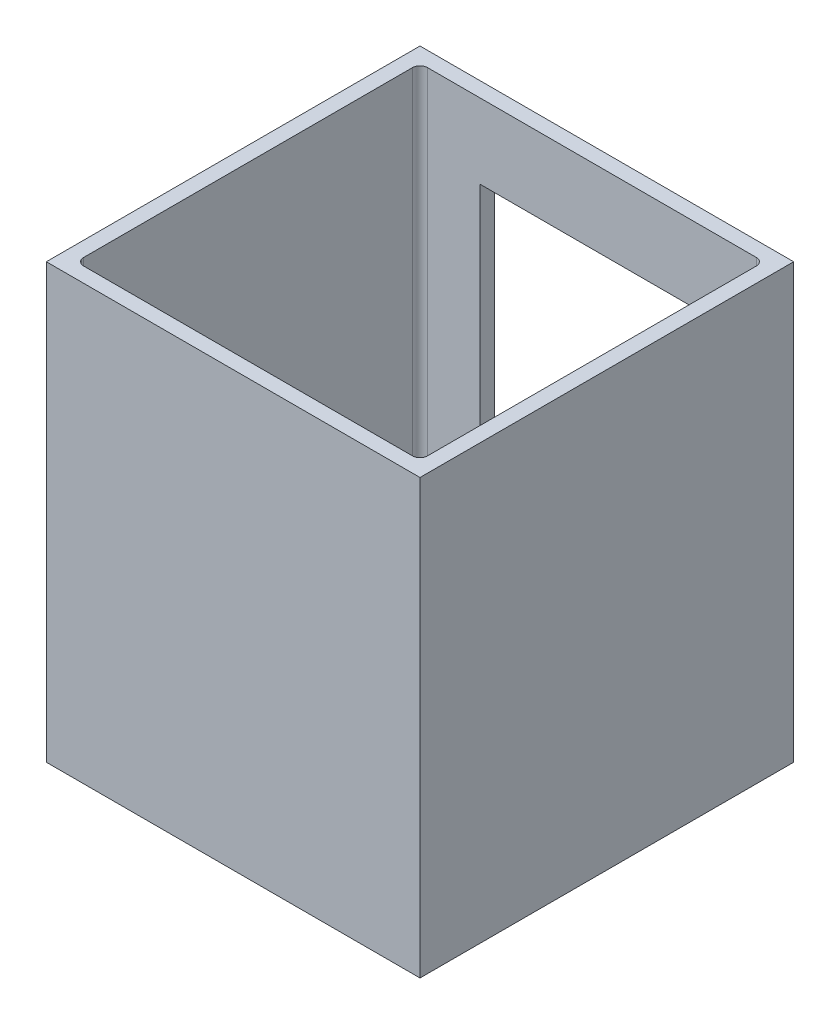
SolidWorks part; units mm, degrees
other "Markup1"
sketch "Sketch15" plane through (63.5, 0, 0) normal (0.5774, 0.5773, 0.5774) x (0.7071, 0, -0.7071)
ref_plane "Front Plane" through (0, 0, 0) normal (0, 0, 1) x (1, 0, 0)
ref_plane "Top Plane" through (0, 0, 0) normal (0, 1, 0) x (1, 0, 0)
ref_plane "Right Plane" through (0, 0, 0) normal (1, 0, 0) x (0, 0, -1)
sketch "Sketch2" plane through (0, 0, 0) normal (0, 1, 0) x (1, 0, 0)
  line L1 (0, 0) -> (63.5, 0)
  line L2 (0, 0) -> (0, 63.5)
  line L3 (0, 63.5) -> (63.5, 63.5)
  line L4 (63.5, 0) -> (63.5, 63.5)
extrude "Boss-Extrude2" add sketch "Sketch2" against normal blind 304.8
sketch "Sketch3" plane through (0, 0, 0) normal (0, 1, 0) x (1, 0, 0)
  line L0 (0, 0) -> (0, 2.54)
  line L1 (0, 63.5) -> (0, 0) construction
  line L2 (0, 2.54) -> (2.54, 2.54)
  line L3 (63.5, 63.5) -> (63.5, 60.96)
  line L4 (63.5, 60.96) -> (60.96, 60.96)
  line L6 (2.54, 2.54) -> (60.96, 2.54)
  line L7 (2.54, 2.54) -> (2.54, 60.96)
  line L8 (2.54, 60.96) -> (60.96, 60.96)
  line L9 (60.96, 2.54) -> (60.96, 60.96)
extrude "Cut-Extrude2" cut sketch "Sketch3" against normal blind 302.26 contours L6 L9 L8 L7
sketch3d "3DSketch1"
  line L0 (0, 0, -63.5) -> (0, 0, 0) construction
  point P0 (0, 0, -61.7439)
sketch "Sketch5" plane through (0, 0, 0) normal (0, 1, 0) x (1, 0, 0)
  line L1 (0, 0) -> (63.5, 0)
  line L2 (0, 0) -> (0, 63.5)
  line L3 (0, 63.5) -> (63.5, 63.5)
  line L4 (63.5, 0) -> (63.5, 63.5)
extrude "Cut-Extrude3" cut sketch "Sketch5" against normal blind 2.54
sketch "Sketch6" plane through (0, 0, 0) normal (0, 0, 1) x (1, 0, 0)
  line L0 (0, -304.8) -> (63.5, -304.8)
  line L1 (63.5, -304.8) -> (31.75, -304.8)
  line L2 (31.75, -304.8) -> (31.75, -152.4)
  circle A0 centre (31.75, -152.4) radius 12.7
extrude "Cut-Extrude4" cut sketch "Sketch6" against normal blind 12.7
sketch "Sketch11" plane through (0, 0, 0) normal (0, 0, 1) x (1, 0, 0)
  line L0 (31.75, -152.4) -> (31.75, -158.75)
  line L1 (44.45, -152.4) -> (44.45, -173.6752)
  line L2 (19.05, -152.4) -> (19.05, -158.75)
  circle A0 centre (31.75, -152.4) radius 12.7 construction
  circle A1 centre (31.75, -158.75) radius 12.7
extrude "Cut-Extrude7" cut sketch "Sketch11" against normal blind 2.54 contours A1 L2 M3 | A1 M3 | A1 L1 M3
sketch "Sketch12" plane through (0, 0, 0) normal (0, 0, 1) x (1, 0, 0)
  line L0 (31.75, -152.4) -> (31.75, -146.05)
  line L1 (19.05, -146.05) -> (19.05, -155.575)
  line L2 (19.05, -152.4) -> (19.05, -158.75) construction
  line L3 (44.45, -146.05) -> (44.45, -158.75)
  circle A0 centre (31.75, -146.05) radius 12.7
extrude "Cut-Extrude8" cut sketch "Sketch12" against normal blind 2.54 contours A0 M3 | A0 L1 M3 | A0 L3 M3
sketch "Sketch14" plane through (0, 0, -63.5) normal (0, 0, -1) x (-1, 0, 0)
  line L0 (-63.5, -304.8) -> (-50.8, -304.8)
  line L1 (-63.5, -304.8) -> (0, -304.8) construction
  line L2 (-50.8, -304.8) -> (-50.8, -292.1)
  line L3 (0, -2.54) -> (0, -15.24)
  line L4 (0, -304.8) -> (0, -2.54) construction
  line L5 (0, -15.24) -> (-12.7, -15.24)
  line L7 (-12.7, -15.24) -> (-50.8, -15.24)
  line L8 (-12.7, -15.24) -> (-12.7, -292.1)
  line L9 (-12.7, -292.1) -> (-50.8, -292.1)
  line L10 (-50.8, -15.24) -> (-50.8, -292.1)
extrude "Cut-Extrude9" cut sketch "Sketch14" against normal blind 2.54 contours L7 L10 L9 L8
fillet "Fillet1" radius 1.27 4 edges at (2.54, -152.4, -2.54) (2.54, -152.4, -60.96) (60.96, -152.4, -60.96) (60.96, -152.4, -2.54)
ref_plane "Plane1" through (63.5, -2.54, 0) normal (0, 1, 0) x (1, 0, 0)
sketch "Sketch17" plane through (0, -304.8, 0) normal (0, -1, 0) x (1, 0, 0)
  line L1 (0, -63.5) -> (63.5, -63.5)
  line L2 (0, -63.5) -> (0, 0)
  line L3 (0, 0) -> (63.5, 0)
  line L4 (63.5, -63.5) -> (63.5, 0)
extrude "Cut-Extrude10" cut sketch "Sketch17" against normal blind 228.6
sketch "Sketch18" plane through (0, -76.2, 0) normal (0, -1, 0) x (1, 0, 0)
  line L0 (3.81, -60.96) -> (2.54, -60.96)
  line L1 (2.54, -60.96) -> (2.54, -59.69)
  line L2 (3.81, -2.54) -> (2.54, -2.54)
  line L3 (2.54, -60.96) -> (7.62, -60.96)
  line L4 (2.54, -60.96) -> (2.54, -55.88)
  line L5 (2.54, -55.88) -> (7.62, -55.88)
  line L6 (7.62, -60.96) -> (7.62, -55.88)
  line L7 (2.54, -2.54) -> (2.54, -3.81)
  line L8 (59.69, -2.54) -> (60.96, -2.54)
  line L9 (2.54, -2.54) -> (7.62, -2.54)
  line L10 (2.54, -2.54) -> (2.54, -7.62)
  line L11 (2.54, -7.62) -> (7.62, -7.62)
  line L12 (7.62, -2.54) -> (7.62, -7.62)
  line L13 (60.96, -2.54) -> (60.96, -3.81)
  line L14 (60.96, -59.69) -> (60.96, -60.96)
  line L15 (60.96, -2.54) -> (55.88, -2.54)
  line L16 (60.96, -2.54) -> (60.96, -7.62)
  line L17 (60.96, -7.62) -> (55.88, -7.62)
  line L18 (55.88, -2.54) -> (55.88, -7.62)
  line L19 (60.96, -60.96) -> (59.69, -60.96)
  line L21 (60.96, -60.96) -> (55.88, -60.96)
  line L22 (60.96, -60.96) -> (60.96, -55.88)
  line L23 (60.96, -55.88) -> (55.88, -55.88)
  line L24 (55.88, -60.96) -> (55.88, -55.88)
  arc A0 (60.96, -3.81) -> (59.69, -2.54) centre (59.69, -3.81) ccw construction
  circle A1 centre (5.08, -5.08) radius 1.651
  circle A2 centre (58.42, -5.08) radius 1.651
  circle A3 centre (5.08, -58.42) radius 1.651
  circle A4 centre (58.42, -58.42) radius 1.651
extrude "Boss-Extrude3" add sketch "Sketch18" against normal blind 3.81 contours L12 L11 A1 M26 M25 M24 | L18 L17 A2 M26 M28 M27 | L24 L23 A4 M30 M29 M28 | L6 L5 A3 M22 M24 M23
